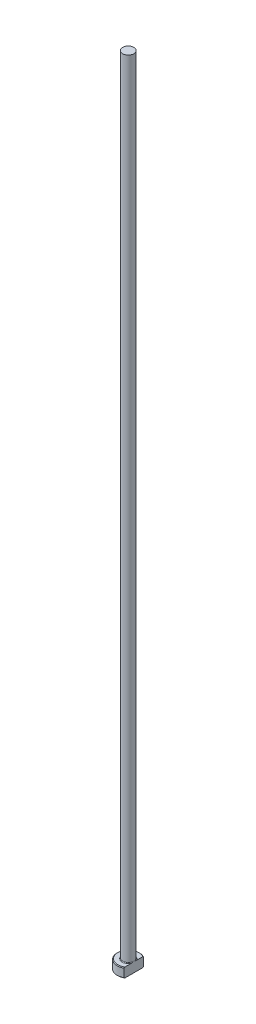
SolidWorks part; units mm, degrees
ref_plane "Front Plane" through (0, 0, 0) normal (0, 0, 1) x (1, 0, 0)
ref_plane "Top Plane" through (0, 0, 0) normal (0, 1, 0) x (1, 0, 0)
ref_plane "Right Plane" through (0, 0, 0) normal (1, 0, 0) x (0, 0, -1)
sketch "Sketch1" plane through (0, 0, 0) normal (0, 0, 1) x (1, 0, 0)
  line L0 (0, 259.9588) -> (0, -15.1925) construction
  line L1 (0, 0) -> (-3.5, 0)
  line L2 (-3.5, 0) -> (-3.5, 3)
  line L3 (-3.5, 3) -> (-1.75, 3)
  line L4 (-1.75, 3) -> (-1.75, 250)
  line L5 (-1.75, 250) -> (0, 250)
  line L6 (0, 250) -> (0, 0)
  dimension "L" = 250
  dimension "H" = 7
  dimension "T" = 3
  dimension "D" = 3.5
revolve "Revolve1" add sketch "Sketch1" angle 360 about L0
chamfer "Chamfer1" distance 0.2 angle 45 2 edges at (0, 3, 3.5) (0, 0, 3.5)
fillet "Fillet1" radius 0.2 1 edges at (0, 3, 1.75)
sketch "Sketch2" plane through (0, 0, 0) normal (0, 1, 0) x (1, 0, 0)
  line L0 (1.75, 3.0311) -> (1.75, -3.0311)
  circle A0 centre (0, 0) radius 3.5 construction
  arc A1 (1.75, -3.0311) -> (1.75, 3.0311) centre (0, 0) ccw
  circle A2 centre (0, 0) radius 1.75 construction
extrude "KEY" cut sketch "Sketch2" along normal through all
